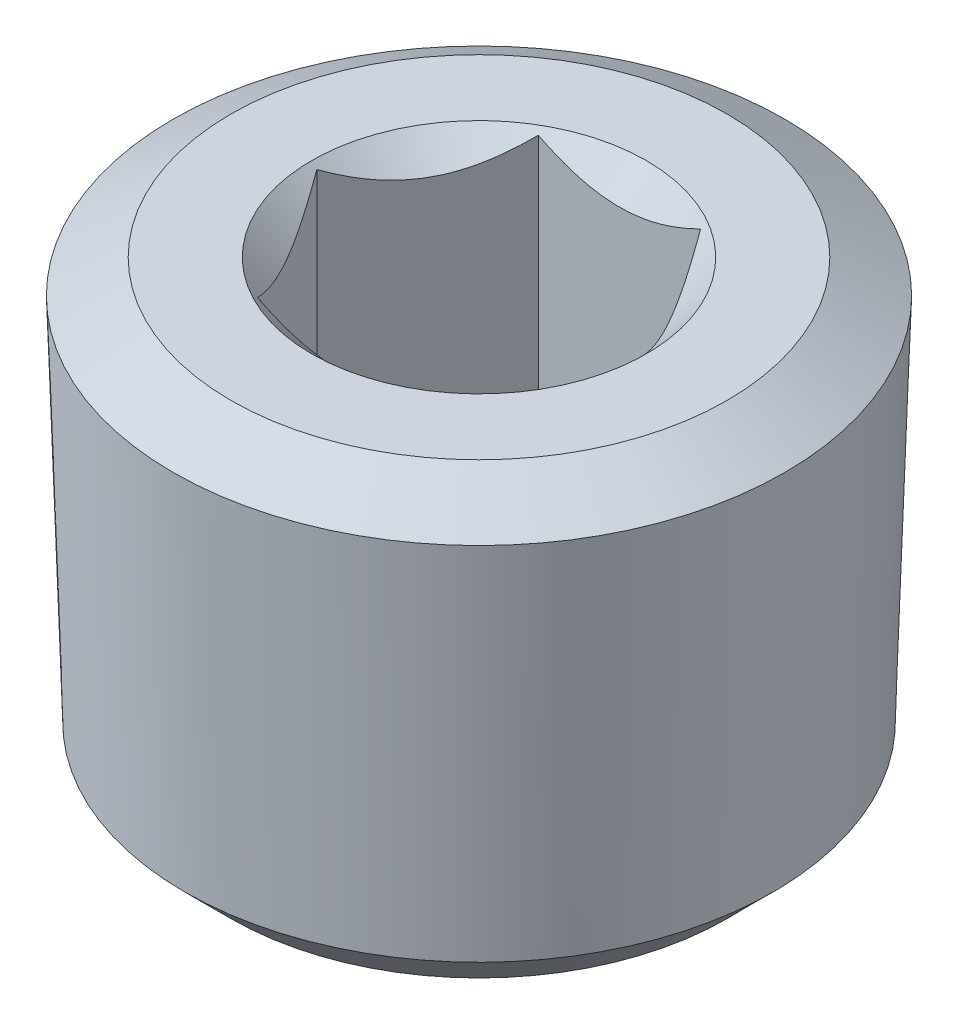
SolidWorks part; units mm, degrees
ref_plane "Front Plane" through (0, 0, 0) normal (0, 0, 1) x (1, 0, 0)
ref_plane "Top Plane" through (0, 0, 0) normal (0, 1, 0) x (1, 0, 0)
ref_plane "Right Plane" through (0, 0, 0) normal (1, 0, 0) x (0, 0, -1)
sketch "Sketch2" plane through (0, 0, 0) normal (0, 0, 1) x (1, 0, 0)
  line L0 (0, 10.7443) -> (0, -17.0657) construction
  line L1 (0, 0) -> (-7.0203, 0)
  line L2 (-8.6573, -0.9451) -> (-8.3313, -11.3891)
  line L3 (-7.0203, -12.7) -> (0, -12.7)
  line L4 (0, -12.7) -> (0, 0)
  line L6 (-7.0203, -12.7) -> (-8.3313, -11.3891)
  line L7 (-7.0203, 0) -> (-8.6573, -0.9451)
  point P4 (-8.6868, 0)
  point P6 (-8.2903, -12.7)
  dimension "D1" = 12.7
  dimension "D2" = 1.788
  dimension "D3" = 17.3736
  dimension "D4" = 30
  dimension "D5" = 1.27
  dimension "D6" = 45
revolve "Revolve1" add sketch "Sketch2" angle 360 about L0
sketch "Sketch3" plane through (0, 0, 0) normal (0, 0, 1) x (1, 0, 0)
  line L0 (0, 2.9342) -> (0, -10.6171) construction
  line L1 (0, 0) -> (-4.7371, 0)
  line L2 (7.0203, 0) -> (-7.0203, 0) construction
  line L3 (-3.9751, -0.762) -> (-3.9751, -6.858)
  line L4 (-3.9751, -6.858) -> (-2.7069, -7.62)
  line L5 (0, -7.62) -> (0, 0)
  line L6 (-3.9751, -0.762) -> (-4.7371, 0)
  line L7 (-2.7069, -7.62) -> (0, -7.62)
  dimension "D1" = 6.858
  dimension "D2" = 59
  dimension "D3" = 7.9502
  dimension "D4" = 0.762
  dimension "D5" = 45
  dimension "D6" = 7.62
revolve "Cut-Revolve1" cut sketch "Sketch3" angle 360 about L0
sketch "Sketch4" plane through (0, 0, 0) normal (0, 1, 0) x (1, 0, 0)
  line L1 (-2.295, -3.9751) -> (2.295, -3.9751)
  line L2 (2.295, -3.9751) -> (4.5901, 0)
  line L3 (4.5901, 0) -> (2.295, 3.9751)
  line L4 (2.295, 3.9751) -> (-2.295, 3.9751)
  line L5 (-2.295, 3.9751) -> (-4.5901, 0)
  line L6 (-4.5901, 0) -> (-2.295, -3.9751)
  circle A0 centre (0, 0) radius 3.9751 construction
  circle A1 centre (0, 0) radius 3.9751 construction
extrude "Cut-Extrude1" cut sketch "Sketch4" against normal up to vertex (5.2929 mm away)
